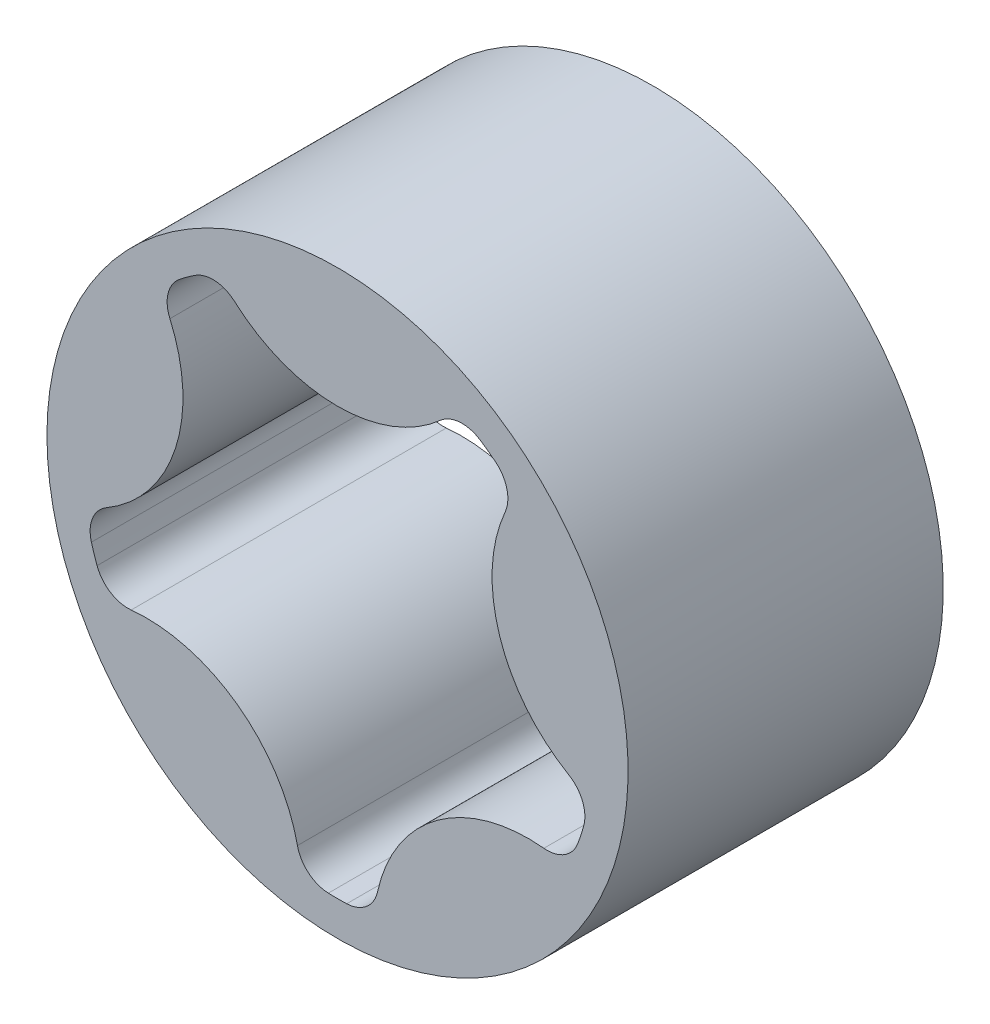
SolidWorks part; units mm, degrees
extrude "Base-Extrude" add sketch "Sketch1" along normal blind 21.971
sketch "Sketch1" plane through (0, 0, 0) normal (0, 0, 1) x (1, 0, 0)
  line L0 (0, 0) -> (21.5444, 7.0002) construction
  line L1 (0, 0) -> (13.3151, -18.3267) construction
  line L2 (0, 0) -> (-13.3151, -18.3267) construction
  line L3 (0, 0) -> (-21.5444, 7.0002) construction
  line L4 (0, 0) -> (0, 22.6531) construction
  arc A0 (-9.9629, 14.8031) -> (-10.9999, 14.0497) centre (0, 0) ccw
  arc A1 (11.6837, 11.3305) -> (16.1122, -2.2991) centre (21.5444, 7.0002) ccw
  arc A2 (14.3864, -7.6105) -> (2.7924, -16.0341) centre (13.3151, -18.3267) ccw
  arc A3 (-2.7924, -16.0341) -> (-14.3864, -7.6105) centre (-13.3151, -18.3267) ccw
  arc A4 (-16.1122, -2.2991) -> (-11.6837, 11.3305) centre (-21.5444, 7.0002) ccw
  arc A5 (-7.1655, 14.6132) -> (7.1655, 14.6132) centre (0, 22.6531) ccw
  arc A6 (-17.1573, -4.9008) -> (-16.7612, -6.1199) centre (0, 0) ccw
  arc A7 (-0.6409, -17.832) -> (0.6409, -17.832) centre (0, 0) ccw
  arc A8 (16.7612, -6.1199) -> (17.1573, -4.9008) centre (0, 0) ccw
  arc A9 (10.9999, 14.0497) -> (9.9629, 14.8031) centre (0, 0) ccw
  circle A10 centre (0, 0) radius 20.2565
  arc A11 (-10.9999, 14.0497) -> (-11.6837, 11.3305) centre (-9.5906, 12.2497) ccw
  arc A12 (-7.1655, 14.6132) -> (-9.9629, 14.8031) centre (-8.6865, 12.9066) ccw
  arc A13 (9.9629, 14.8031) -> (7.1655, 14.6132) centre (8.6865, 12.9066) ccw
  arc A14 (11.6837, 11.3305) -> (10.9999, 14.0497) centre (9.5906, 12.2497) ccw
  arc A15 (17.1573, -4.9008) -> (16.1122, -2.2991) centre (14.9592, -4.273) ccw
  arc A16 (16.7612, -6.1199) -> (14.3864, -7.6105) centre (14.6138, -5.3359) cw
  arc A17 (2.7924, -16.0341) -> (0.6409, -17.832) centre (0.5588, -15.5475) cw
  arc A18 (-2.7924, -16.0341) -> (-0.6409, -17.832) centre (-0.5588, -15.5475) ccw
  arc A19 (-16.7612, -6.1199) -> (-14.3864, -7.6105) centre (-14.6138, -5.3359) ccw
  arc A20 (-16.1122, -2.2991) -> (-17.1573, -4.9008) centre (-14.9592, -4.273) ccw
  dimension "D1" = 72
  dimension "D6" = 35.687
  dimension "D7" = 10.7696
  dimension "D8" = 40.513
  dimension "D5" = 1.1176
  dimension "D9" = 2.286
  dimension "D2" = 72
  dimension "D3" = 72
  dimension "D4" = 72
ref_plane "Plane1" through (0, 0, 0) normal (0, 0, 1) x (1, 0, 0)
ref_plane "Plane2" through (0, 0, 0) normal (0, 1, 0) x (-1, 0, 0)
ref_plane "Plane3" through (0, 0, 0) normal (1, 0, 0) x (0, 0, -1)
